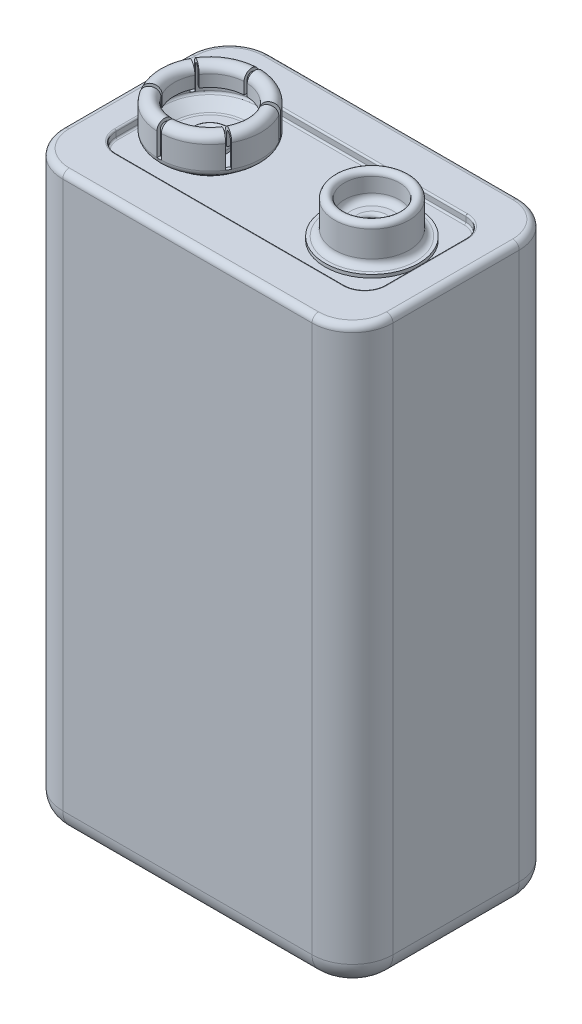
SolidWorks part; units mm, degrees
ref_plane "Front Plane" through (0, 0, 0) normal (0, 0, 1) x (1, 0, 0)
ref_plane "Top Plane" through (0, 0, 0) normal (0, 1, 0) x (1, 0, 0)
ref_plane "Right Plane" through (0, 0, 0) normal (1, 0, 0) x (0, 0, -1)
sketch "Sketch1" plane through (0, 0, 0) normal (0, 1, 0) x (1, 0, 0)
  line L0 (-12.954, -8.128) -> (12.954, 8.128) construction
  line L1 (-12.954, 8.128) -> (12.954, 8.128)
  line L2 (-12.954, 8.128) -> (-12.954, -8.128)
  line L3 (-12.954, -8.128) -> (12.954, -8.128)
  line L4 (12.954, 8.128) -> (12.954, -8.128)
  dimension "D1" = 16.256
  dimension "D2" = 25.908
extrude "Extrude1" add sketch "Sketch1" along normal blind 45.212
fillet "Fillet1" radius 3.175 4 edges at (-12.954, 22.606, 8.128) (-12.954, 22.606, -8.128) (12.954, 22.606, -8.128) (12.954, 22.606, 8.128)
fillet "Fillet2" radius 1.778 8 edges at (-12.0241, 0, 7.1981) (-12.954, 0, 0) (-12.0241, 0, -7.1981) (0, 0, -8.128) (12.0241, 0, -7.1981) (12.954, 0, 0) (12.0241, 0, 7.1981) (0, 0, 8.128)
sketch "Sketch3" plane through (0, 45.212, 0) normal (0, 1, 0) x (1, 0, 0)
  line L0 (-10.541, -4.7625) -> (10.541, 4.7625) construction
  line L1 (-8.9535, 4.7625) -> (8.9535, 4.7625)
  line L2 (-10.541, 3.175) -> (-10.541, -3.175)
  line L3 (-8.9535, -4.7625) -> (8.9535, -4.7625)
  line L4 (10.541, 3.175) -> (10.541, -3.175)
  arc A0 (-8.9535, 4.7625) -> (-10.541, 3.175) centre (-8.9535, 3.175) ccw
  arc A1 (8.9535, 4.7625) -> (10.541, 3.175) centre (8.9535, 3.175) cw
  arc A2 (8.9535, -4.7625) -> (10.541, -3.175) centre (8.9535, -3.175) ccw
  arc A3 (-10.541, -3.175) -> (-8.9535, -4.7625) centre (-8.9535, -3.175) ccw
  point P7 (-10.541, 4.7625)
  dimension "D3" = 1.5875
  dimension "D1" = 21.082
  dimension "D2" = 9.525
extrude "Extrude2" cut sketch "Sketch3" against normal blind 0.635
sketch "Sketch4" plane through (0, 0, 0) normal (0, 0, 1) x (1, 0, 0)
  line L0 (6.35, 44.577) -> (6.35, 54.1097) construction
  line L1 (8.9535, 44.577) -> (-8.9535, 44.577) construction
  line L2 (-6.35, 44.577) -> (-6.35, 54.1097) construction
  line L3 (-6.35, 44.577) -> (6.35, 44.577) construction
  line L4 (0, 44.577) -> (0, 0) construction
  dimension "D1" = 12.7
fillet "Fillet3" radius 0.508 8 edges at (-12.0241, 45.212, 7.1981) (-12.954, 45.212, 0) (-12.0241, 45.212, -7.1981) (0, 45.212, -8.128) (12.0241, 45.212, -7.1981) (12.954, 45.212, 0) (12.0241, 45.212, 7.1981) (0, 45.212, 8.128)
fillet "Fillet4" radius 0.127 16 edges at (-10.076, 44.577, 4.2975) (-10.541, 44.577, 0) (-10.076, 44.577, -4.2975) (0, 44.577, -4.7625) (10.076, 44.577, -4.2975) (10.541, 44.577, 0) (10.076, 44.577, 4.2975) (-10.076, 45.212, 4.2975) (-10.541, 45.212, 0) (-10.076, 45.212, -4.2975) (0, 45.212, -4.7625) (10.076, 45.212, -4.2975) (10.541, 45.212, 0) (10.076, 45.212, 4.2975) (0, 44.577, 4.7625) (0, 45.212, 4.7625)
sketch "Sketch5" plane through (0, 0, 0) normal (0, 0, 1) x (1, 0, 0)
  line L0 (-9.144, 46.609) -> (-9.144, 47.5298)
  line L1 (-10.3505, 47.5298) -> (-10.3505, 45.72)
  line L2 (-10.1522, 45.3173) -> (-9.3267, 44.6823)
  line L3 (-9.017, 44.577) -> (-7.239, 44.577)
  line L4 (-6.35, 44.577) -> (-6.35, 54.1097) construction
  line L5 (-9.398, 46.609) -> (-9.398, 47.5298)
  line L6 (-10.0965, 47.5298) -> (-10.0965, 45.72)
  line L7 (-9.9974, 45.5187) -> (-9.1719, 44.8837)
  line L8 (-9.017, 44.831) -> (-7.747, 44.831)
  line L9 (-9.398, 46.609) -> (-9.144, 46.609)
  line L10 (-7.239, 44.577) -> (-7.239, 45.085)
  line L11 (-6.35, 44.577) -> (6.35, 44.577) construction
  line L12 (-7.747, 45.085) -> (-7.747, 44.831)
  line L13 (-9.017, 44.831) -> (-7.239, 44.831) construction
  arc A0 (-9.144, 47.5298) -> (-10.3505, 47.5298) centre (-9.7472, 47.5298) ccw
  arc A1 (-10.3505, 45.72) -> (-10.1522, 45.3173) centre (-9.8425, 45.72) ccw
  arc A2 (-9.3267, 44.6823) -> (-9.017, 44.577) centre (-9.017, 45.085) ccw
  arc A3 (-9.398, 47.5298) -> (-10.0965, 47.5298) centre (-9.7472, 47.5298) ccw
  arc A4 (-10.0965, 45.72) -> (-9.9974, 45.5187) centre (-9.8425, 45.72) ccw
  arc A5 (-9.1719, 44.8837) -> (-9.017, 44.831) centre (-9.017, 45.085) ccw
  arc A6 (-7.239, 45.085) -> (-7.747, 45.085) centre (-7.493, 45.085) ccw
  dimension "D1" = 0.508
  dimension "D4" = 0.508
  dimension "D7" = 3.556
  dimension "D2" = 2.794
  dimension "D3" = 4.0005
  dimension "D6" = 2.667
  dimension "D8" = 1.524
  dimension "D9" = 2.413
  dimension "D10" = 0.889
  dimension "D11" = 0.508
  dimension "D12" = 0.508
  dimension "D5" = 0.254
sketch "Sketch7" plane through (0, 0, 0) normal (0, 0, 1) x (1, 0, 0)
  line L0 (-10.3505, 45.72) -> (-10.0965, 45.72)
  line L11 (-10.0965, 45.72) -> (-10.0965, 47.5298)
  line L12 (-9.1719, 44.8837) -> (-9.9974, 45.5187)
  line L13 (-7.747, 44.831) -> (-9.017, 44.831)
  line L14 (-7.747, 45.085) -> (-7.747, 44.831)
  line L15 (-7.239, 44.577) -> (-7.239, 45.085)
  line L16 (-9.017, 44.577) -> (-7.239, 44.577)
  line L17 (-10.1522, 45.3173) -> (-9.3267, 44.6823)
  line L18 (-10.3505, 47.5298) -> (-10.3505, 45.72)
  line L19 (-9.144, 46.609) -> (-9.144, 47.5298)
  line L20 (-9.398, 46.609) -> (-9.144, 46.609)
  line L21 (-9.398, 47.5298) -> (-9.398, 46.609)
  line L23 (-9.1719, 44.8837) -> (-9.9974, 45.5187)
  line L24 (-7.747, 44.831) -> (-9.017, 44.831)
  line L25 (-7.747, 45.085) -> (-7.747, 44.831)
  line L26 (-7.239, 44.577) -> (-7.239, 45.085)
  line L27 (-9.017, 44.577) -> (-7.239, 44.577)
  line L28 (-10.1522, 45.3173) -> (-9.3267, 44.6823)
  arc A7 (-10.0965, 45.72) -> (-9.9974, 45.5187) centre (-9.8425, 45.72) ccw
  arc A8 (-9.1719, 44.8837) -> (-9.017, 44.831) centre (-9.017, 45.085) ccw
  arc A9 (-7.239, 45.085) -> (-7.747, 45.085) centre (-7.493, 45.085) ccw
  arc A10 (-9.3267, 44.6823) -> (-9.017, 44.577) centre (-9.017, 45.085) ccw
  arc A11 (-10.3505, 45.72) -> (-10.1522, 45.3173) centre (-9.8425, 45.72) ccw
  arc A12 (-9.144, 47.5298) -> (-10.3505, 47.5298) centre (-9.7472, 47.5298) ccw
  arc A13 (-9.398, 47.5298) -> (-10.0965, 47.5298) centre (-9.7472, 47.5298) ccw
  arc A14 (-10.0965, 45.72) -> (-9.9974, 45.5187) centre (-9.8425, 45.72) ccw
  arc A15 (-9.1719, 44.8837) -> (-9.017, 44.831) centre (-9.017, 45.085) ccw
  arc A16 (-7.239, 45.085) -> (-7.747, 45.085) centre (-7.493, 45.085) ccw
  arc A17 (-9.3267, 44.6823) -> (-9.017, 44.577) centre (-9.017, 45.085) ccw
  arc A18 (-10.3505, 45.72) -> (-10.1522, 45.3173) centre (-9.8425, 45.72) ccw
  dimension "D1" = 0
revolve "Revolve2" add sketch "Sketch7" angle 360 about L2
sketch "Sketch6" plane through (0, 0, 0) normal (0, 0, 1) x (1, 0, 0)
  line L0 (-10.3505, 45.72) -> (-10.0965, 45.72)
  line L11 (-10.0965, 45.72) -> (-10.0965, 47.5298)
  line L12 (-9.1719, 44.8837) -> (-9.9974, 45.5187)
  line L13 (-7.747, 44.831) -> (-9.017, 44.831)
  line L14 (-7.747, 45.085) -> (-7.747, 44.831)
  line L15 (-7.239, 44.577) -> (-7.239, 45.085)
  line L16 (-9.017, 44.577) -> (-7.239, 44.577)
  line L17 (-10.1522, 45.3173) -> (-9.3267, 44.6823)
  line L18 (-10.3505, 47.5298) -> (-10.3505, 45.72)
  line L19 (-9.144, 46.609) -> (-9.144, 47.5298)
  line L20 (-9.398, 46.609) -> (-9.144, 46.609)
  line L21 (-9.398, 47.5298) -> (-9.398, 46.609)
  line L22 (-10.0965, 45.72) -> (-10.0965, 47.5298)
  line L29 (-10.3505, 47.5298) -> (-10.3505, 45.72)
  line L30 (-9.144, 46.609) -> (-9.144, 47.5298)
  line L31 (-9.398, 46.609) -> (-9.144, 46.609)
  line L32 (-9.398, 47.5298) -> (-9.398, 46.609)
  arc A7 (-10.0965, 45.72) -> (-9.9974, 45.5187) centre (-9.8425, 45.72) ccw
  arc A8 (-9.1719, 44.8837) -> (-9.017, 44.831) centre (-9.017, 45.085) ccw
  arc A9 (-7.239, 45.085) -> (-7.747, 45.085) centre (-7.493, 45.085) ccw
  arc A10 (-9.3267, 44.6823) -> (-9.017, 44.577) centre (-9.017, 45.085) ccw
  arc A11 (-10.3505, 45.72) -> (-10.1522, 45.3173) centre (-9.8425, 45.72) ccw
  arc A12 (-9.144, 47.5298) -> (-10.3505, 47.5298) centre (-9.7472, 47.5298) ccw
  arc A13 (-9.398, 47.5298) -> (-10.0965, 47.5298) centre (-9.7472, 47.5298) ccw
  arc A19 (-9.144, 47.5298) -> (-10.3505, 47.5298) centre (-9.7472, 47.5298) ccw
  arc A20 (-9.398, 47.5298) -> (-10.0965, 47.5298) centre (-9.7472, 47.5298) ccw
  dimension "D1" = 0
revolve "Revolve3" add sketch "Sketch6" angle 55 mid plane about L2
pattern_circular "CirPattern1" count 6 over 360 about axis through (-6.35, 0, 0) along (0, 1, 0) of "Revolve3"
sketch "Sketch8" plane through (0, 0, 0) normal (0, 0, 1) x (1, 0, 0)
  line L0 (2.667, 44.577) -> (2.667, 44.831)
  line L1 (-6.35, 44.577) -> (6.35, 44.577) construction
  line L2 (2.667, 44.831) -> (2.921, 44.831)
  line L3 (3.429, 45.339) -> (3.429, 47.371)
  line L4 (4.191, 47.371) -> (4.191, 46.228)
  line L5 (6.35, 44.577) -> (6.35, 54.1097) construction
  line L6 (4.699, 45.72) -> (5.207, 45.72)
  line L7 (5.461, 45.466) -> (5.461, 44.577)
  line L8 (5.461, 44.577) -> (2.667, 44.577)
  arc A0 (2.921, 44.831) -> (3.429, 45.339) centre (2.921, 45.339) ccw
  arc A1 (3.429, 47.371) -> (4.191, 47.371) centre (3.81, 47.371) cw
  arc A2 (4.191, 46.228) -> (4.699, 45.72) centre (4.699, 46.228) ccw
  arc A3 (5.207, 45.72) -> (5.461, 45.466) centre (5.207, 45.466) cw
  dimension "D3" = 0.508
  dimension "D4" = 0.508
  dimension "D7" = 0.254
  dimension "D1" = 0.762
  dimension "D2" = 0.254
  dimension "D5" = 3.683
  dimension "D6" = 2.921
  dimension "D8" = 2.032
  dimension "D9" = 3.175
  dimension "D10" = 0.889
revolve "Revolve4" add sketch "Sketch8" angle 360 about L0
